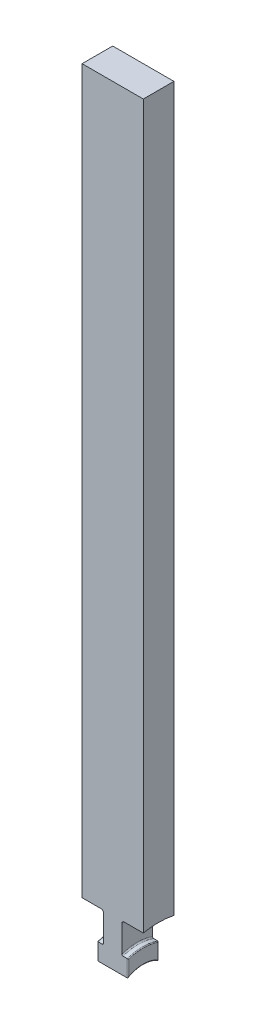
SolidWorks part; units mm, degrees
ref_plane "Front Plane" through (0, 0, 0) normal (0, 0, 1) x (1, 0, 0)
ref_plane "Top Plane" through (0, 0, 0) normal (0, 1, 0) x (1, 0, 0)
ref_plane "Right Plane" through (0, 0, 0) normal (1, 0, 0) x (0, 0, -1)
sketch "Sketch1" plane through (0, 0, 0) normal (1, 0, 0) x (0, 0, -1)
  line L0 (-5, 260) -> (-5, 0)
  line L1 (0, 249.2329) -> (0, 0) construction
  line L2 (5, 260) -> (5, 0)
  line L3 (-5, 260) -> (5, 260)
  line L6 (-5, 0) -> (5, 0)
  arc A0 (-10, 0) -> (10, 0) centre (0, 0) cw construction
  dimension "R" = 10
  dimension "L" = 250
  dimension "T" = 10
extrude "Boss-Extrude1" add sketch "Sketch1" along normal mid plane 20
sketch "Sketch8" plane through (0, 0, 0) normal (1, 0, 0) x (0, 0, -1)
  circle A0 centre (0, 0) radius 10
  arc A1 (10, 0) -> (-10, 0) centre (0, 0) ccw construction
extrude "Cut-Extrude4" cut sketch "Sketch8" against normal through all both and the other way through all
sketch "Sketch2" plane through (0, 0, 0) normal (0, 0, 1) x (1, 0, 0)
  line L0 (10, 15) -> (3, 15)
  line L1 (10, 260) -> (10, 8.6603) construction
  line L2 (3, 15) -> (3, 24.5)
  line L3 (3, 24.5) -> (10, 24.5)
  line L4 (10, 24.5) -> (10, 15)
  line L5 (0, 29.9173) -> (0, 0) construction
  line L6 (-10, 24.5) -> (-10, 15)
  line L7 (-3, 24.5) -> (-10, 24.5)
  line L8 (-3, 15) -> (-3, 24.5)
  line L9 (-10, 15) -> (-3, 15)
  line L10 (-8.8482, 0) -> (24.5305, 0) construction
  dimension "D1" = 6
  dimension "D2" = 24.5
  dimension "D3" = 15
revolve "Cut-Revolve1" cut sketch "Sketch2" angle 360 about L10
sketch "Sketch7" plane through (0, 0, 0) normal (0, 0, 1) x (1, 0, 0)
  line L6 (-10, 15) -> (-5, 15)
  line L8 (-10, 15) -> (-10, 0)
  line L9 (-10, 0) -> (-5, 0)
  line L10 (-5, 15) -> (-5, 0)
  line L11 (0, 16.5651) -> (0, 5.9342) construction
  line L12 (5, 15) -> (5, 0)
  line L13 (10, 0) -> (5, 0)
  line L14 (10, 15) -> (10, 0)
  line L15 (10, 15) -> (5, 15)
  dimension "MW" = 10
extrude "Cut-Extrude3" cut sketch "Sketch7" against normal through all both and the other way through all
fillet "Fillet1" radius 0.762 2 edges at (-3, 24.5, 0) (3, 24.5, 0)
fillet "Fillet2" radius 0.381 2 edges at (-3, 15, 0) (3, 15, 0)
fillet "Fillet3" radius 0.25 8 edges at (-5, 10, 0) (-5, 11.4012, -5) (-5, 15, 0) (-5, 11.4012, 5) (5, 10, 0) (5, 11.4012, 5) (5, 15, 0) (5, 11.4012, -5)
